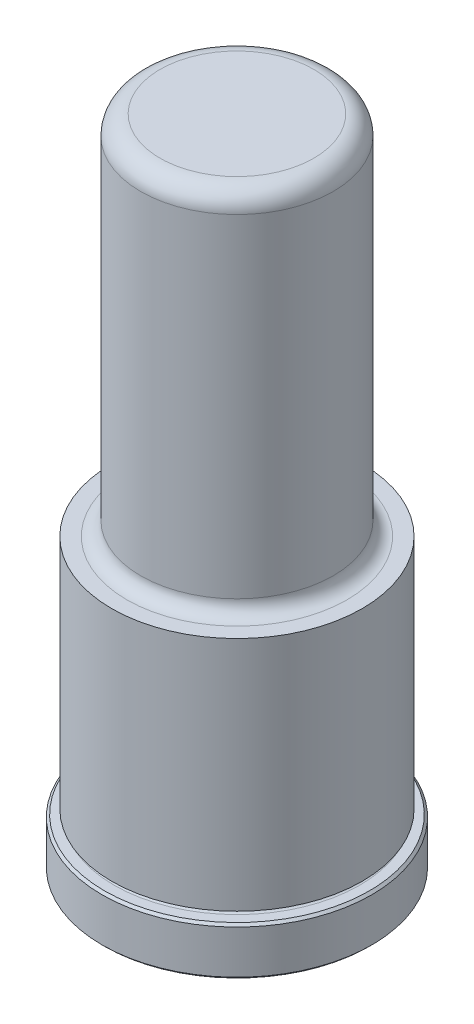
SolidWorks part; units mm, degrees
ref_plane "Front Plane" through (0, 0, 0) normal (0, 0, 1) x (1, 0, 0)
ref_plane "Top Plane" through (0, 0, 0) normal (0, 1, 0) x (1, 0, 0)
ref_plane "Right Plane" through (0, 0, 0) normal (1, 0, 0) x (0, 0, -1)
sketch "Sketch1" plane through (0, 0, 0) normal (1, 0, 0) x (0, 0, -1)
  line L0 (0, 0) -> (22.225, 0)
  line L1 (22.225, 0) -> (22.225, 7.9248)
  line L2 (22.225, 7.9248) -> (20.2438, 7.9248)
  line L3 (19.8628, 2.6782) -> (19.8628, 5.9795) construction
  line L4 (20.2438, 8.6868) -> (20.6502, 8.6868)
  line L5 (20.6502, 8.6868) -> (20.6502, 47.625)
  line L6 (20.6502, 47.625) -> (18.1483, 47.625)
  line L7 (15.8623, 49.911) -> (15.8623, 107.95)
  line L9 (15.8623, 107.95) -> (0, 107.95)
  line L10 (0, 107.95) -> (0, 0)
  line L11 (0, 0) -> (0, -7.2694) construction
  arc A0 (20.2438, 8.6868) -> (20.2438, 7.9248) centre (20.2438, 8.3058) ccw
  arc A1 (18.1483, 47.625) -> (15.8623, 49.911) centre (18.1483, 49.911) cw
  point P2 (15.8623, 107.95)
  point P14 (15.8623, 107.6994)
  point P19 (15.8623, 47.625)
  dimension "D14" = 0.762
  dimension "D8" = 2.286
  dimension "T" = 7.9248
  dimension "D2" = 0.762
  dimension "M" = 44.45
  dimension "B" = 41.3004
  dimension "L" = 107.95
  dimension "D7" = 0.7874
  dimension "A" = 47.625
  dimension "D" = 31.7246
  dimension "D15" = 60.325
revolve "Revolve1" add sketch "Sketch1" angle 360 about L11
chamfer "Chamfer1" distance 0.381 angle 45 2 edges at (0, 0, 22.225) (0, 7.9248, 22.225)
fillet "Fillet7" radius 3.175 1 edges at (0, 107.95, 15.8623)
